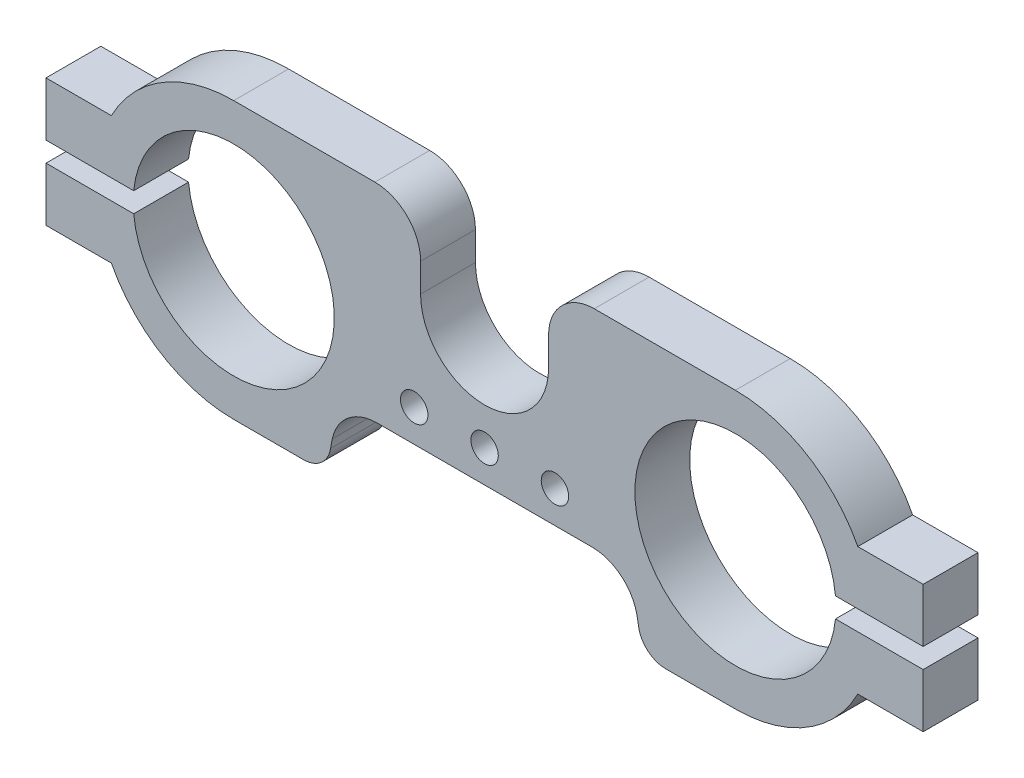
SolidWorks part; units mm, degrees
ref_plane "Front Plane" through (0, 0, 0) normal (0, 0, 1) x (1, 0, 0)
ref_plane "Top Plane" through (0, 0, 0) normal (0, 1, 0) x (1, 0, 0)
ref_plane "Right Plane" through (0, 0, 0) normal (1, 0, 0) x (0, 0, -1)
sketch "Sketch1" plane through (0, 0, 0) normal (0, 0, 1) x (1, 0, 0)
  line L0 (-254.7822, 22.7704) -> (-227.3422, 22.7704) construction
  line L1 (-199.9022, 22.7704) -> (-254.7822, 22.7704) construction
  line L2 (-199.9022, 7.6671) -> (-207.532, 7.6671)
  line L3 (-199.9022, 37.8738) -> (-215.3422, 37.8738)
  line L4 (-247.1523, 7.6671) -> (-254.7822, 7.6671)
  line L5 (-239.1144, 15.1732) -> (-215.5699, 15.1732)
  line L6 (-234.3422, 29.757) -> (-234.3422, 32.8738)
  line L7 (-227.3422, 27.0769) -> (-227.3422, 22.7704) construction
  line L8 (-220.3422, 29.757) -> (-220.3422, 32.8738)
  line L9 (-239.3422, 37.8738) -> (-254.7822, 37.8738)
  line L10 (-275.3206, 23.8608) -> (-275.3206, 27.0769)
  line L11 (-275.3206, 21.6801) -> (-265.728, 21.6801)
  line L12 (-275.3206, 27.0769) -> (-275.3206, 29.757)
  line L13 (-275.3206, 23.8608) -> (-265.728, 23.8608)
  line L14 (-179.3637, 15.7839) -> (-186.5119, 15.7839)
  line L15 (-275.3206, 21.6801) -> (-264.4504, 23.8608) construction
  line L16 (-275.3206, 23.8608) -> (-264.4504, 21.6801) construction
  line L17 (-179.3637, 18.464) -> (-179.3637, 15.7839)
  line L18 (-275.3206, 29.757) -> (-268.1724, 29.757)
  line L19 (-275.3206, 15.7839) -> (-268.1724, 15.7839)
  line L20 (-275.3206, 18.464) -> (-275.3206, 21.6801)
  line L21 (-264.4504, 18.464) -> (-275.3206, 27.0769) construction
  line L22 (-264.4504, 27.0769) -> (-275.3206, 18.464) construction
  line L23 (-275.3206, 18.464) -> (-275.3206, 15.7839)
  line L24 (-179.3637, 18.464) -> (-179.3637, 21.6801)
  line L25 (-179.3637, 21.6801) -> (-188.9563, 21.6801)
  line L26 (-179.3637, 23.8608) -> (-188.9563, 23.8608)
  line L27 (-179.3637, 23.8608) -> (-179.3637, 27.0769)
  line L28 (-179.3637, 27.0769) -> (-179.3637, 29.757)
  line L29 (-179.3637, 29.757) -> (-186.5119, 29.757)
  arc A0 (-265.728, 21.6801) -> (-265.728, 23.8608) centre (-254.7822, 22.7704) ccw
  arc A1 (-199.9022, 7.6671) -> (-186.5119, 15.7839) centre (-199.9022, 22.7704) ccw
  arc A2 (-254.7822, 37.8738) -> (-268.1724, 29.757) centre (-254.7822, 22.7704) ccw
  arc A3 (-210.4982, 10.2179) -> (-210.6795, 11.2143) centre (-227.3422, 7.6671) ccw
  arc A4 (-244.0048, 11.2143) -> (-244.1861, 10.2179) centre (-227.3422, 7.6671) ccw
  arc A5 (-234.3422, 29.757) -> (-220.3422, 29.757) centre (-227.3422, 29.757) ccw
  circle A6 centre (-235.0401, 18.6986) radius 1.5
  circle A7 centre (-219.6442, 18.6986) radius 1.5
  circle A8 centre (-227.3422, 18.6986) radius 1.5
  arc A9 (-215.3422, 37.8738) -> (-220.3422, 32.8738) centre (-215.3422, 32.8738) ccw
  arc A10 (-239.3422, 37.8738) -> (-234.3422, 32.8738) centre (-239.3422, 32.8738) cw
  arc A11 (-210.6795, 11.2143) -> (-215.5699, 15.1732) centre (-215.5699, 10.1732) ccw
  arc A12 (-239.1144, 15.1732) -> (-244.0048, 11.2143) centre (-239.1144, 10.1732) ccw
  arc A13 (-207.532, 7.6671) -> (-210.4982, 10.2179) centre (-207.532, 10.6671) cw
  arc A14 (-244.1861, 10.2179) -> (-247.1523, 7.6671) centre (-247.1523, 10.6671) cw
  arc A15 (-186.5119, 29.757) -> (-199.9022, 37.8738) centre (-199.9022, 22.7704) ccw
  arc A16 (-268.1724, 15.7839) -> (-254.7822, 7.6671) centre (-254.7822, 22.7704) ccw
  arc A17 (-188.9563, 21.6801) -> (-188.9563, 23.8608) centre (-199.9022, 22.7704) cw
  point P4 (-227.3422, 22.7704)
  point P28 (-220.3422, 37.8738)
  point P31 (-234.3422, 37.8738)
  point P36 (-242.6354, 15.1732)
  point P41 (-269.8855, 22.7704)
  point P46 (-269.8855, 22.7704)
  dimension "D3" = 5
  dimension "D4" = 5
  dimension "D5" = 3
  dimension "D1" = 30.2067
  dimension "D2" = 54.88
extrude "Boss-Extrude1" add sketch "Sketch1" along normal blind 6
